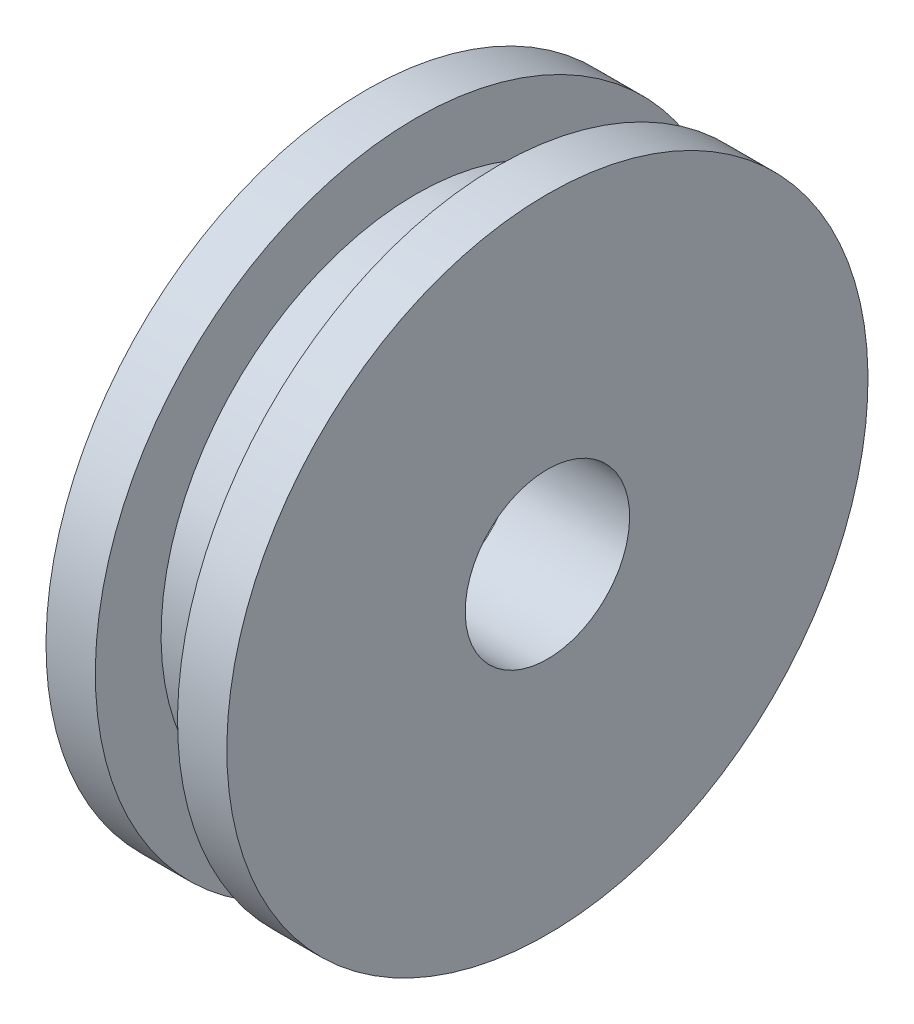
SolidWorks part; units mm, degrees
ref_plane "Plan1" through (0, 0, 0) normal (0, 0, 1) x (1, 0, 0)
ref_plane "Plan2" through (0, 0, 0) normal (0, 1, 0) x (1, 0, 0)
ref_plane "Plan3" through (0, 0, 0) normal (1, 0, 0) x (0, 0, -1)
sketch "Esquisse1" plane through (0, 0, 0) normal (0, 0, 1) x (1, 0, 0)
  line L0 (15.4372, 0) -> (20.9372, 0)
  line L1 (15.4372, 0) -> (15.4372, 9.75)
  line L2 (20.9372, 0) -> (20.9372, 9.75)
  line L3 (15.4372, 9.75) -> (16.9372, 9.75)
  line L4 (20.9372, 9.75) -> (19.4372, 9.75)
  line L5 (16.9372, 9.75) -> (16.9372, 7.75)
  line L6 (19.4372, 9.75) -> (19.4372, 7.75)
  line L7 (16.9372, 7.75) -> (19.4372, 7.75)
  line L8 (20.9372, 0) -> (15.4372, 0) construction
  point P12 (18.1872, 7.75)
  dimension "D1" = 9.75
  dimension "D2" = 2.5
  dimension "D3" = 5.5
  dimension "D4" = 1.5
  dimension "D5" = 2
  dimension "D6" = 15.4372
revolve "Base-Révolution" add sketch "Esquisse1" angle 360 about L8
sketch "Esquisse2" plane through (20.9372, 0, 0) normal (1, 0, 0) x (0, 0, -1)
  circle A0 centre (0, 0) radius 2.5
  dimension "D1" = 5
extrude "Enlèv. mat.-Extru.1" cut sketch "Esquisse2" against normal through all
sketch "Esquisse3" plane through (15.4372, 0, 0) normal (-1, 0, 0) x (0, 0, 1)
  circle A0 centre (0, 0) radius 6
  dimension "D1" = 12
extrude "Enlèv. mat.-Extru.2" cut sketch "Esquisse3" against normal blind 2
chamfer "Chanfrein1" distance 0.5 angle 45
